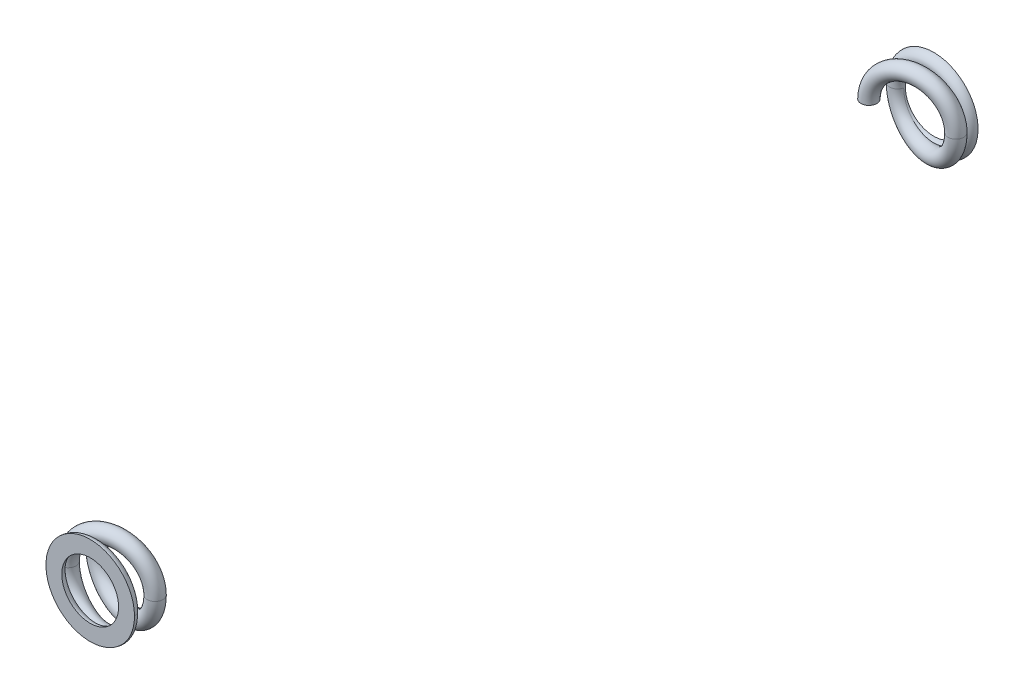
SolidWorks part; units mm, degrees
ref_plane "Front" through (0, 0, 0) normal (0, 0, 1) x (1, 0, 0)
ref_plane "Top" through (0, 0, 0) normal (0, 1, 0) x (1, 0, 0)
ref_plane "Right" through (0, 0, 0) normal (1, 0, 0) x (0, 0, -1)
sketch "Logo3_Revol_Axis" plane through (0, 0, 0) normal (0, 1, 0) x (1, 0, 0)
  line L0 (0, -10.7188) -> (0, 76.4472) construction
  line L1 (0, 0) -> (0, 53.7025) construction
sketch "Logo3_bib0" plane through (0, 0, 0) normal (0, 1, 0) x (1, 0, 0)
  line L0 (0, 0) -> (0, 79.375) construction
  line L1 (0, 79.375) -> (1.397, 79.375) construction
  dimension "Logo3_l0" = 79.375
  dimension "Logo3_d2" = 1.397
sketch "logo3_bib1" plane through (0, 0, 0) normal (0, 1, 0) x (1, 0, 0)
  line L0 (-3.9688, 0) -> (3.9688, 0) construction
  line L1 (3.9688, 0) -> (3.9688, 74.295) construction
  line L2 (3.9688, 74.295) -> (-3.9688, 74.295) construction
  line L3 (-3.9688, 74.295) -> (-3.9688, 0) construction
  line L4 (3.8989, 0) -> (3.8989, 74.295) construction
  line L5 (-3.8989, 74.295) -> (-3.8989, 0) construction
  line L6 (2.5019, 0) -> (2.5019, 74.295) construction
  line L7 (-2.5019, 0) -> (-2.5019, 74.295) construction
  line L8 (0, 0) -> (0, 74.295) construction
  line L9 (3.2004, 74.295) -> (3.2004, 0) construction
  line L10 (-3.2004, 74.295) -> (-3.2004, 0) construction
  line L11 (3.2004, 0) -> (-3.2004, 1.2573) construction
  line L12 (0, 0.6287) -> (1.9275, 10.4411) construction
  line L13 (-3.2004, 1.2573) -> (3.2004, 2.5146) construction
  line L14 (-3.2004, 74.295) -> (3.2004, 73.0377) construction
  line L15 (3.2004, 2.5146) -> (-3.2004, 3.7719) construction
  line L16 (0, 1.8859) -> (-1.9275, 11.6984) construction
  line L17 (0, 3.1433) -> (1.9275, 12.9557) construction
  line L18 (0, 73.6663) -> (-1.9275, 63.8539) construction
  line L19 (-22.523, 75.5523) -> (29.4917, 75.5523) construction
  line L20 (-22.523, -1.2573) -> (25.6601, -1.2573) construction
  line L21 (3.2004, 73.0377) -> (-3.2004, 71.7804) construction
  line L22 (0, 72.4091) -> (1.9275, 62.5966) construction
  line L23 (-3.9688, 74.295) -> (3.9688, 74.295) construction
  circle A0 centre (-3.2004, 74.295) radius 0.6985
  circle A1 centre (3.2004, 73.0377) radius 0.6985
  circle A2 centre (3.2004, 2.5146) radius 0.6985
  circle A3 centre (3.2004, 0) radius 0.6985
  circle A4 centre (-3.2004, 1.2573) radius 0.6985
  circle A5 centre (-3.2004, 3.7719) radius 0.6985
  circle A6 centre (-3.2004, 71.7804) radius 0.6985
sketch "Sketch4" plane through (0, 0, 0) normal (0, 1, 0) x (1, 0, 0)
  line L0 (0, 0) -> (0, 74.295) construction
  line L1 (0, 0) -> (0, 74.295) construction
  circle A0 centre (3.2004, 0) radius 0.6985 construction
  circle A1 centre (-3.2004, 74.295) radius 0.6985 construction
  circle A2 centre (3.2004, 0) radius 0.6985
  circle A3 centre (-3.2004, 74.295) radius 0.6985
revolve "Revolve2" add sketch "Sketch4" angle 360 about L1
sketch "Sketch5" plane through (0, 0, 0) normal (0, 1, 0) x (1, 0, 0)
  line L0 (0, 0.6287) -> (1.9275, 10.4411) construction
  line L1 (0, 0.6287) -> (1.9275, 10.4411) construction
  circle A0 centre (3.2004, 0) radius 0.6985 construction
  circle A1 centre (3.2004, 0) radius 0.6985
revolve "Revolve3" add sketch "Sketch5" angle 180 about L1
sketch "Sketch6" plane through (0, 0, 0) normal (0, 1, 0) x (1, 0, 0)
  line L0 (0, 1.8859) -> (-1.9275, 11.6984) construction
  line L1 (0, 1.8859) -> (-1.9275, 11.6984) construction
  circle A0 centre (-3.2004, 1.2573) radius 0.6985 construction
  circle A1 centre (-3.2004, 1.2573) radius 0.6985
revolve "Revolve4" add sketch "Sketch6" angle 180 about L1
sketch "Sketch7" plane through (0, 0, 0) normal (0, 1, 0) x (1, 0, 0)
  line L0 (0, 3.1433) -> (1.9275, 12.9557) construction
  line L1 (0, 3.1433) -> (1.9275, 12.9557) construction
  circle A0 centre (3.2004, 2.5146) radius 0.6985 construction
  circle A1 centre (3.2004, 2.5146) radius 0.6985
revolve "Revolve5" add sketch "Sketch7" angle 180 about L1
sketch "Sketch8" plane through (0, 0, 0) normal (0, 1, 0) x (1, 0, 0)
  line L0 (0, 73.6663) -> (-1.9275, 63.8539) construction
  line L1 (0, 73.6663) -> (-1.9275, 63.8539) construction
  circle A0 centre (-3.2004, 74.295) radius 0.6985 construction
  circle A1 centre (-3.2004, 74.295) radius 0.6985
revolve "Revolve6" add sketch "Sketch8" angle 180 about L1
sketch "Sketch10" plane through (0, 0, 0) normal (0, 1, 0) x (1, 0, 0)
  line L0 (0, 72.4091) -> (1.9275, 62.5966) construction
  line L1 (0, 72.4091) -> (1.9275, 62.5966) construction
  circle A0 centre (3.2004, 73.0377) radius 0.6985 construction
  circle A1 centre (3.2004, 73.0377) radius 0.6985
revolve "Revolve7" add sketch "Sketch10" angle 180 about L1
sketch "Sketch9" plane through (0, 0, 0) normal (0, 1, 0) x (1, 0, 0)
  line L1 (-3.8989, 0) -> (3.8989, 0)
  line L2 (-3.8989, 0) -> (-3.8989, -1.2573)
  line L3 (-3.8989, -1.2573) -> (3.8989, -1.2573)
  line L4 (3.8989, 0) -> (3.8989, -1.2573)
  line L6 (3.8989, 74.295) -> (-3.8989, 74.295)
  line L7 (3.8989, 74.295) -> (3.8989, 75.5523)
  line L8 (3.8989, 75.5523) -> (-3.8989, 75.5523)
  line L9 (-3.8989, 74.295) -> (-3.8989, 75.5523)
  line L10 (-22.523, -1.2573) -> (25.6601, -1.2573) construction
  line L11 (-22.523, 75.5523) -> (29.4917, 75.5523) construction
  line L12 (-3.8989, 74.295) -> (-3.8989, 0) construction
  line L13 (3.8989, 0) -> (3.8989, 74.295) construction
extrude "Cut-Extrude1" cut sketch "Sketch9" against normal through all and the other way through all
sketch "Sketch11" plane through (0, 0, 0) normal (0, 1, 0) x (1, 0, 0)
  line L0 (3.2004, 74.295) -> (3.2004, 0) construction
  line L1 (-3.2004, 74.295) -> (-3.2004, 0) construction
  line L2 (3.2004, 74.295) -> (3.2004, 0) construction
  line L3 (-3.2004, 74.295) -> (-3.2004, 0) construction
equation "\"Ray1@logo3_bib1\" = \"Logo3_d1/2-1.05*d2@logo3_bib1\""
equation "\"Ray2@logo3_bib1\" = \"Logo3_(d1-(.1*d2))/2@logo3_bib1\""
equation "\"Ray3@logo3_bib1\" = (\"Ray1@logo3_bib1\"+\"Ray2@logo3_bib1\")/2"
equation "\"Ray3bis@logo3_bib1\" = \"Ray3@logo3_bib1\""
equation "\"Dist1@logo3_bib1\" = (\"Logo3_(d1-(.1*d2))/2@logo3_bib1\"-\"Logo3_d1/2-1.05*d2@logo3_bib1\")*.9"
equation "\"Dist2@logo3_bib1\" = \"Dist1@logo3_bib1\"*2"
equation "\"Dist3@logo3_bib1\" = \"Dist1@logo3_bib1\"*3"
equation "\"Dist1bis@logo3_bib1\" = \"Dist1@logo3_bib1\""
equation "\"Dist4@logo3_bib1\" = \"Dist1@logo3_bib1\""
equation "\"Dist5@logo3_bib1\" = \"Dist4@logo3_bib1\""
equation "\"Dist2bis@logo3_bib1\" = \"Dist2@logo3_bib1\""
